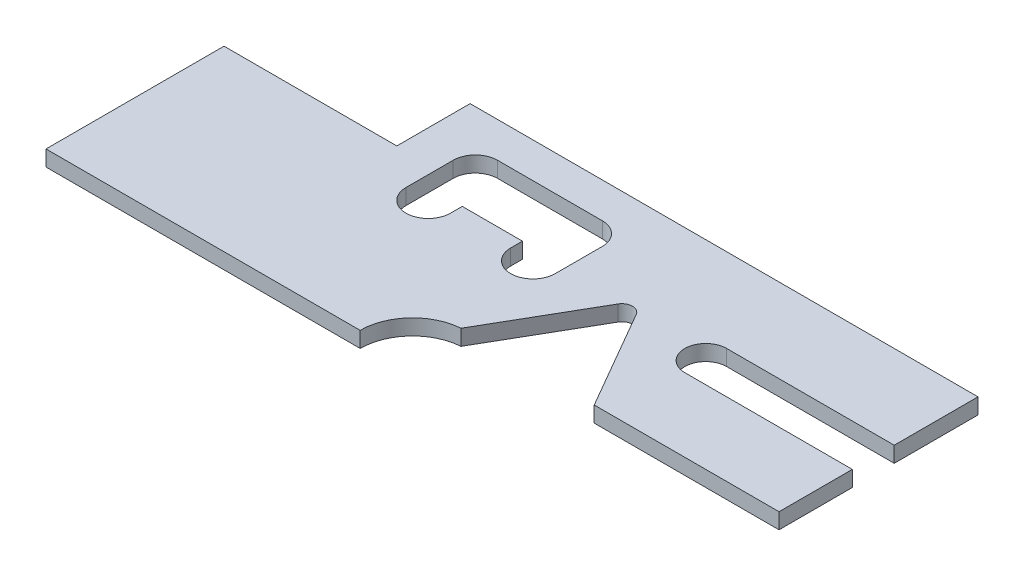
SolidWorks part; units mm, degrees
ref_plane "Front Plane" through (0, 0, 0) normal (0, 0, 1) x (1, 0, 0)
ref_plane "Top Plane" through (0, 0, 0) normal (0, 1, 0) x (1, 0, 0)
ref_plane "Right Plane" through (0, 0, 0) normal (1, 0, 0) x (0, 0, -1)
sketch "Sketch1" plane through (0, 0, 0) normal (0, 1, 0) x (1, 0, 0)
  line L0 (33, 48) -> (33, 34)
  line L1 (0, 0) -> (60, 0)
  line L2 (0, 0) -> (0, 34)
  line L3 (33, 48) -> (130, 48)
  line L4 (130, 10) -> (130, 24)
  line L5 (33, 34) -> (0, 34)
  line L6 (98, 32) -> (130, 32)
  line L7 (98, 24) -> (130, 24)
  line L8 (94.7017, 10) -> (83.7321, 29)
  line L9 (69.2835, 9.9743) -> (80.2679, 29)
  line L10 (130, 32) -> (130, 48)
  line L11 (130, 10) -> (94.7017, 10)
  line L12 (69.25, 28) -> (69.25, 37)
  line L13 (65, 41.25) -> (45, 41.25)
  line L14 (40.75, 37) -> (40.75, 28)
  line L15 (45, 28) -> (65, 28) construction
  line L16 (65, 28) -> (82, 28) construction
  line L17 (82, 28) -> (98, 28) construction
  line L18 (60.75, 28) -> (60.75, 30.25)
  line L19 (49.25, 28) -> (49.25, 30.25)
  line L20 (49.25, 30.25) -> (60.75, 30.25)
  arc A0 (98, 32) -> (98, 24) centre (98, 28) ccw
  arc A1 (83.7321, 29) -> (80.2679, 29) centre (82, 28) ccw
  arc A2 (69.2835, 9.9743) -> (60, 0) centre (70, 0) ccw
  arc A3 (60.75, 28) -> (69.25, 28) centre (65, 28) ccw
  arc A4 (40.75, 28) -> (49.25, 28) centre (45, 28) ccw
  arc A5 (40.75, 37) -> (45, 41.25) centre (45, 37) cw
  arc A6 (69.25, 37) -> (65, 41.25) centre (65, 37) ccw
  dimension "D1" = 8
  dimension "D2" = 2
  dimension "D3" = 4.25
  dimension "D4" = 10
  dimension "D8" = 20
  dimension "D13" = 32
  dimension "D14" = 16
  dimension "D16" = 17
  dimension "D17" = 20
  dimension "D18" = 9
  dimension "D20" = 4.25
  dimension "D5" = 18
  dimension "D6" = 120
  dimension "D7" = 60
  dimension "D9" = 14
  dimension "D10" = 34
  dimension "D11" = 130
  dimension "D12" = 60
  dimension "D15" = 33
  dimension "D19" = 11
extrude "Extrude1" add sketch "Sketch1" along normal blind 3
